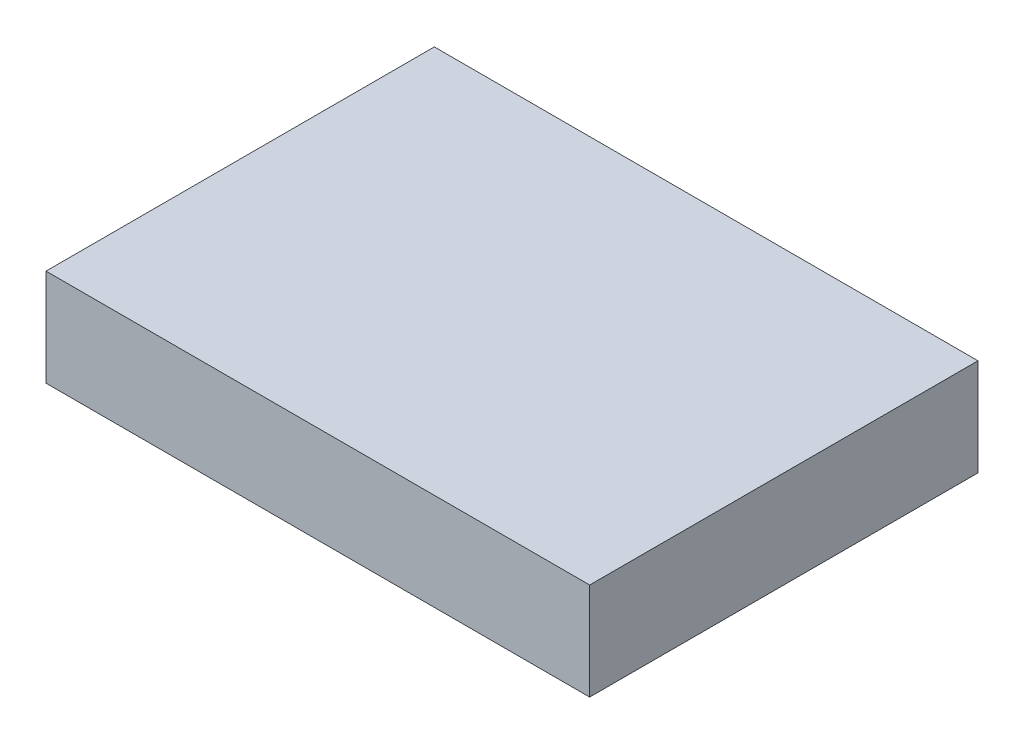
SolidWorks part; units mm, degrees
ref_plane "Front Plane" through (0, 0, 0) normal (0, 0, 1) x (1, 0, 0)
ref_plane "Top Plane" through (0, 0, 0) normal (0, 1, 0) x (1, 0, 0)
ref_plane "Right Plane" through (0, 0, 0) normal (1, 0, 0) x (0, 0, -1)
sketch "Sketch1" plane through (0, 0, 0) normal (0, 1, 0) x (1, 0, 0)
  line L1 (14, -10) -> (-14, -10)
  line L2 (14, -10) -> (14, 10)
  line L3 (14, 10) -> (-14, 10)
  line L4 (-14, -10) -> (-14, 10)
  line L5 (14, -10) -> (-14, 10) construction
  line L6 (14, 10) -> (-14, -10) construction
  point P0 (0, 0)
  dimension "D1" = 28
  dimension "D2" = 20
extrude "Boss-Extrude1" add sketch "Sketch1" along normal mid plane 5
